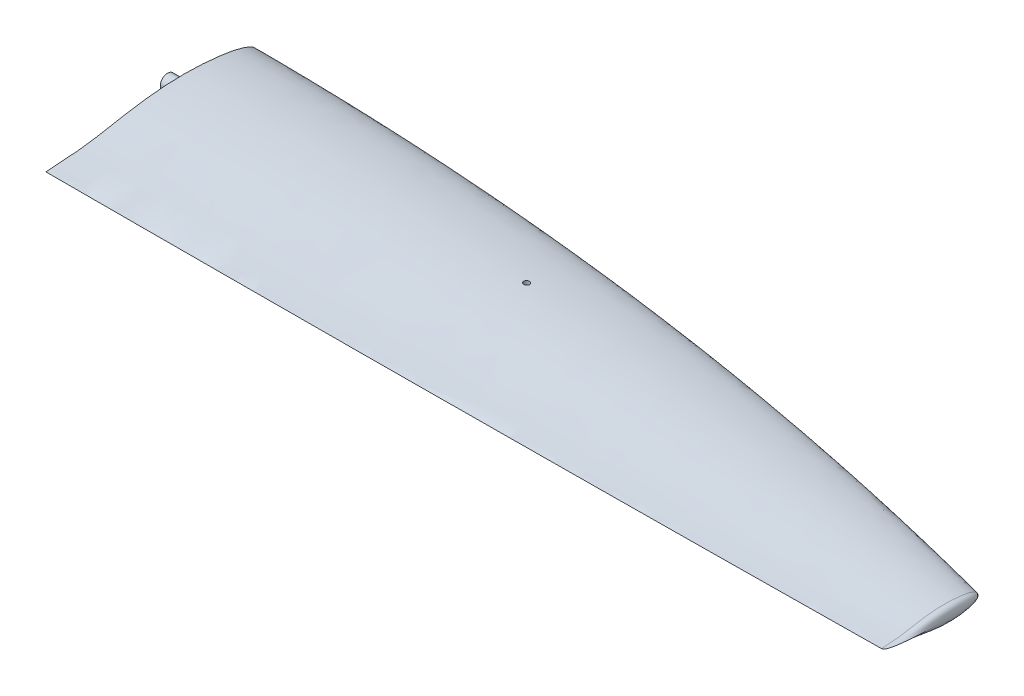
SolidWorks part; units mm, degrees
other "<Gouverne de profondeur gauche>-<Enlèv. mat.-Extru.2>"
ref_plane "Front Plane" through (0, 0, 0) normal (0, 0, 1) x (1, 0, 0)
ref_plane "Top Plane" through (0, 0, 0) normal (0, 1, 0) x (1, 0, 0)
ref_plane "Right Plane" through (0, 0, 0) normal (1, 0, 0) x (0, 0, -1)
mirrored part "Gouverne de profondeur gauche_Symétrique"
